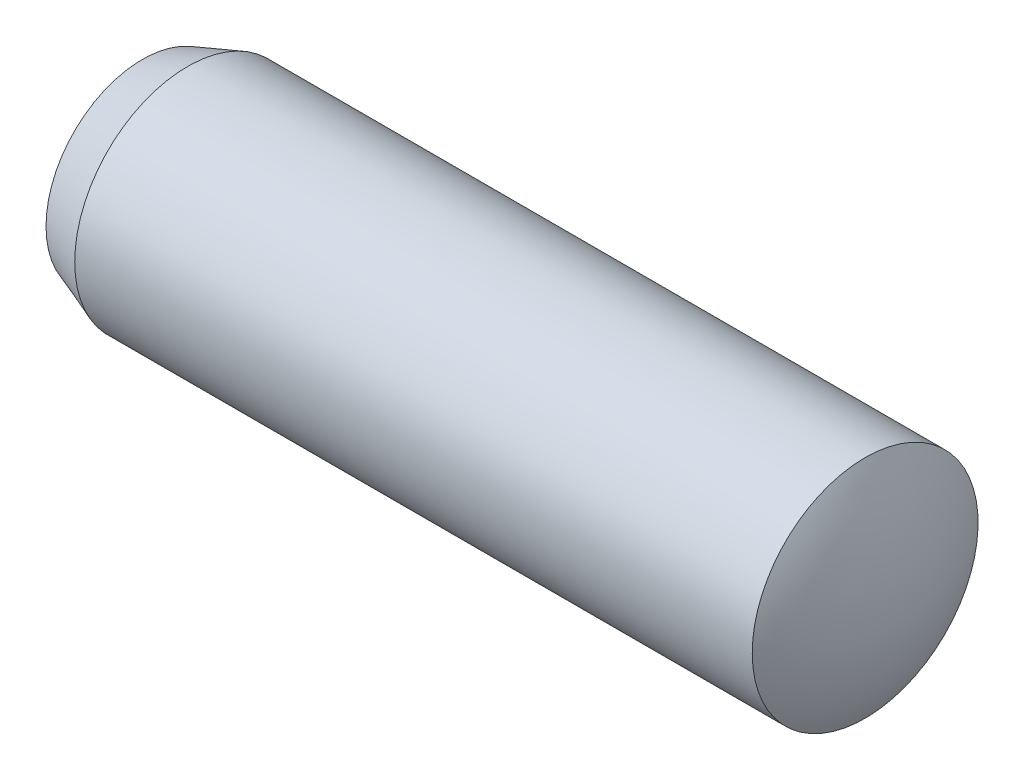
SolidWorks part; units mm, degrees
ref_plane "Plan1" through (0, 0, 0) normal (0, 0, 1) x (1, 0, 0)
ref_plane "Plan2" through (0, 0, 0) normal (0, 1, 0) x (1, 0, 0)
ref_plane "Plan3" through (0, 0, 0) normal (1, 0, 0) x (0, 0, -1)
sketch "Esquisse1" plane through (0, 0, 0) normal (0, 0, 1) x (1, 0, 0)
  line L0 (0, 0) -> (0, 2.5632)
  line L1 (0, 2.5632) -> (1.2, 3)
  line L2 (1.2, 3) -> (19.2, 3)
  line L3 (0, 0) -> (20, 0) construction
  line L4 (0, 0) -> (20, 0)
  arc A0 (19.2, 3) -> (20, 0) centre (13.975, 0) cw
  dimension "D1" = 20
  dimension "D2" = 3
  dimension "D3" = 0.8
  dimension "D4" = 1.2
  dimension "D5" = 20
revolve "Base-Révolution" add sketch "Esquisse1" angle 360 about L3
